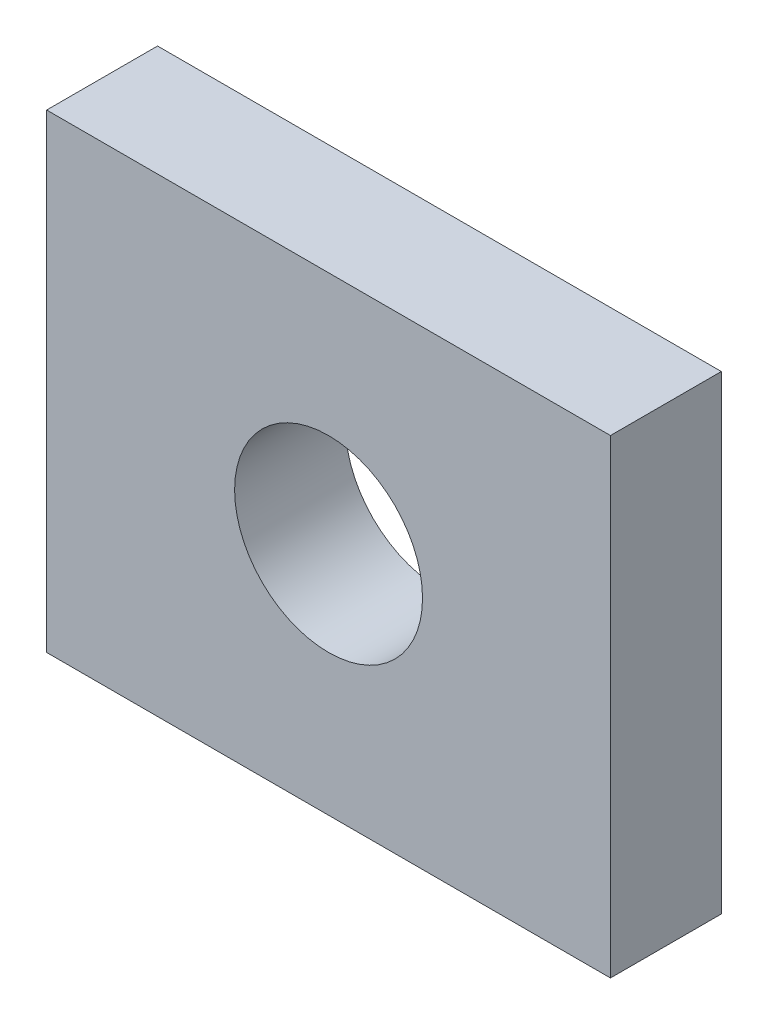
SolidWorks part; units mm, degrees
ref_plane "Front Plane" through (0, 0, 0) normal (0, 0, 1) x (1, 0, 0)
ref_plane "Top Plane" through (0, 0, 0) normal (0, 1, 0) x (1, 0, 0)
ref_plane "Right Plane" through (0, 0, 0) normal (1, 0, 0) x (0, 0, -1)
sketch "Sketch1" plane through (0, 0, 0) normal (0, 0, 1) x (1, 0, 0)
  line L1 (0, 0) -> (15.24, 0)
  line L2 (0, 0) -> (0, 12.7)
  line L3 (0, 12.7) -> (15.24, 12.7)
  line L4 (15.24, 0) -> (15.24, 12.7)
  circle A0 centre (7.62, 6.35) radius 2.54
  dimension "D4" = 5.08
  dimension "D1" = 12.7
  dimension "D2" = 15.24
  dimension "D3" = 7.62
extrude "Boss-Extrude1" add sketch "Sketch1" along normal blind 2.9972
